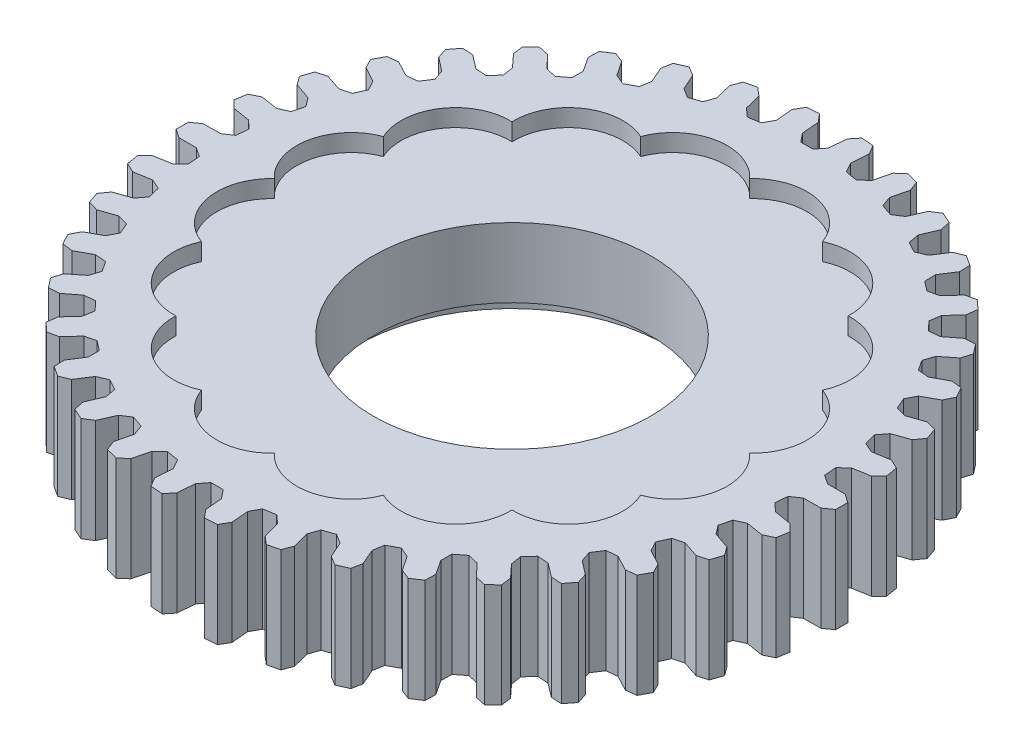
SolidWorks part; units mm, degrees
ref_plane "Front" through (0, 0, 0) normal (0, 0, 1) x (1, 0, 0)
ref_plane "Top" through (0, 0, 0) normal (0, 1, 0) x (1, 0, 0)
ref_plane "Right" through (0, 0, 0) normal (1, 0, 0) x (0, 0, -1)
sketch "Sketch1" plane through (0, 0, 0) normal (0, 0, 1) x (1, 0, 0)
  line L0 (9.5, 3.2951) -> (0, 3.2951)
  line L1 (4.5, 0.2951) -> (9.5, 0.2951)
  line L2 (4.5, 0.2951) -> (4.5, 0.7951)
  line L3 (0, 3.2951) -> (0, 0.7951)
  line L4 (9.5, 0.2951) -> (9.5, 3.2951)
  line L5 (4.5, 0.7951) -> (0, 0.7951)
  dimension "D1" = 3
  dimension "D2" = 9.5
  dimension "D3" = 0.5
  dimension "D5" = 4.5
revolve "Revolve1" add sketch "Sketch1" angle 360 about L3
sketch "Sketch2" plane through (0, 3.2951, 0) normal (0, 1, 0) x (-1, 0, 0)
  arc A16 (-2.6205, -6.3264) -> (-4.842, -4.842) centre (-3.2738, -4.8996) cw
  arc A17 (-4.842, -4.842) -> (-6.3264, -2.6205) centre (-4.8996, -3.2738) cw
  arc A18 (-6.3264, -2.6205) -> (-6.8476, 0) centre (-5.7795, -1.1496) cw
  arc A19 (-6.8476, 0) -> (-6.3264, 2.6205) centre (-5.7795, 1.1496) cw
  arc A20 (-6.3264, 2.6205) -> (-4.842, 4.842) centre (-4.8996, 3.2738) cw
  arc A21 (-4.842, 4.842) -> (-2.6205, 6.3264) centre (-3.2738, 4.8996) cw
  arc A22 (-2.6205, 6.3264) -> (0, 6.8476) centre (-1.1496, 5.7795) cw
  arc A23 (0, 6.8476) -> (2.6205, 6.3264) centre (1.1496, 5.7795) cw
  arc A24 (2.6205, 6.3264) -> (4.842, 4.842) centre (3.2738, 4.8996) cw
  arc A25 (4.842, 4.842) -> (6.3264, 2.6205) centre (4.8996, 3.2738) cw
  arc A26 (6.3264, 2.6205) -> (6.8476, 0) centre (5.7795, 1.1496) cw
  arc A27 (6.8476, 0) -> (6.3264, -2.6205) centre (5.7795, -1.1496) cw
  arc A28 (6.3264, -2.6205) -> (4.842, -4.842) centre (4.8996, -3.2738) cw
  arc A29 (4.842, -4.842) -> (2.6205, -6.3264) centre (3.2738, -4.8996) cw
  arc A30 (2.6205, -6.3264) -> (0, -6.8476) centre (1.1496, -5.7795) cw
  arc A31 (0, -6.8476) -> (-2.6205, -6.3264) centre (-1.1496, -5.7795) cw
extrude "Cut-Extrude1" cut sketch "Sketch2" against normal blind 0.5
sketch "Sketch3" plane through (0, 3.2951, 0) normal (0, 1, 0) x (-1, 0, 0)
  line L0 (2.1568, 9.2453) -> (1.9273, 9.0458)
  line L1 (1.9273, 9.0458) -> (1.8053, 8.5613)
  line L2 (1.8053, 8.5613) -> (1.5711, 8.348)
  line L3 (1.5711, 8.348) -> (1.2246, 8.4058)
  line L4 (1.2246, 8.4058) -> (1.0699, 8.6838)
  line L5 (1.0699, 8.6838) -> (1.1068, 9.1821)
  line L6 (1.1068, 9.1821) -> (0.9521, 9.4455)
  line L7 (0.9521, 9.4455) -> (0.6057, 9.4742)
  line L8 (0.6057, 9.4742) -> (0.4122, 9.2396)
  line L9 (0.4122, 9.2396) -> (0.3716, 8.7417)
  line L10 (0.3716, 8.7417) -> (0.1756, 8.4927)
  line L11 (0.1756, 8.4927) -> (-0.1756, 8.4927)
  line L12 (-0.1756, 8.4927) -> (-0.3741, 8.7415)
  line L13 (-0.3741, 8.7415) -> (-0.4196, 9.239)
  line L14 (-0.4196, 9.239) -> (-0.6156, 9.4734)
  line L15 (-0.6156, 9.4734) -> (-0.962, 9.4447)
  line L16 (3.6491, 8.7642) -> (3.3899, 8.6052)
  line L17 (3.3899, 8.6052) -> (3.1899, 8.1474)
  line L18 (3.1899, 8.1474) -> (2.9237, 7.9756)
  line L19 (2.9237, 7.9756) -> (2.5915, 8.0896)
  line L20 (2.5915, 8.0896) -> (2.4846, 8.3893)
  line L21 (2.4846, 8.3893) -> (2.603, 8.8747)
  line L22 (2.603, 8.8747) -> (2.4937, 9.16)
  line L23 (2.4937, 9.16) -> (2.1568, 9.2453)
  line L24 (5.0419, 8.0441) -> (4.7601, 7.9298)
  line L25 (4.7601, 7.9298) -> (4.4874, 7.5113)
  line L26 (4.4874, 7.5113) -> (4.1966, 7.3855)
  line L27 (4.1966, 7.3855) -> (3.8876, 7.5527)
  line L28 (3.8876, 7.5527) -> (3.8315, 7.8659)
  line L29 (3.8315, 7.8659) -> (4.0282, 8.3252)
  line L30 (4.0282, 8.3252) -> (3.9674, 8.6246)
  line L31 (3.9674, 8.6246) -> (3.6491, 8.7642)
  line L32 (6.2971, 7.1045) -> (6.0003, 7.0382)
  line L33 (6.0003, 7.0382) -> (5.6625, 6.6702)
  line L34 (5.6625, 6.6702) -> (5.3549, 6.5941)
  line L35 (5.3549, 6.5941) -> (5.0778, 6.8098)
  line L36 (5.0778, 6.8098) -> (5.074, 7.128)
  line L37 (5.074, 7.128) -> (5.3436, 7.5486)
  line L38 (5.3436, 7.5486) -> (5.3329, 7.854)
  line L39 (5.3329, 7.854) -> (5.0419, 8.0441)
  line L40 (7.3806, 5.9711) -> (7.077, 5.9546)
  line L41 (7.077, 5.9546) -> (6.6831, 5.6472)
  line L42 (6.6831, 5.6472) -> (6.3673, 5.6228)
  line L43 (6.3673, 5.6228) -> (6.1294, 5.8812)
  line L44 (6.1294, 5.8812) -> (6.178, 6.1957)
  line L45 (6.178, 6.1957) -> (6.5131, 6.5661)
  line L46 (6.5131, 6.5661) -> (6.5529, 6.8691)
  line L47 (6.5529, 6.8691) -> (6.2971, 7.1045)
  line L48 (8.2628, 4.6749) -> (7.9605, 4.7086)
  line L49 (7.9605, 4.7086) -> (7.5215, 4.4702)
  line L50 (7.5215, 4.4702) -> (7.2059, 4.4981)
  line L51 (7.2059, 4.4981) -> (7.0138, 4.7921)
  line L52 (7.0138, 4.7921) -> (7.1135, 5.0943)
  line L53 (7.1135, 5.0943) -> (7.5051, 5.4046)
  line L54 (7.5051, 5.4046) -> (7.5941, 5.6968)
  line L55 (7.5941, 5.6968) -> (7.3806, 5.9711)
  line L56 (8.9195, 3.2511) -> (8.627, 3.3341)
  line L57 (8.627, 3.3341) -> (8.1547, 3.1712)
  line L58 (8.1547, 3.1712) -> (7.848, 3.2507)
  line L59 (7.848, 3.2507) -> (7.7069, 3.5723)
  line L60 (7.7069, 3.5723) -> (7.855, 3.854)
  line L61 (7.855, 3.854) -> (8.2923, 4.0955)
  line L62 (8.2923, 4.0955) -> (8.4282, 4.3692)
  line L63 (8.4282, 4.3692) -> (8.2628, 4.6749)
  line L64 (9.333, 1.7387) -> (9.0581, 1.8687)
  line L65 (9.0581, 1.8687) -> (8.5654, 1.7858)
  line L66 (8.5654, 1.7858) -> (8.276, 1.9146)
  line L67 (8.276, 1.9146) -> (8.1897, 2.2551)
  line L68 (8.1897, 2.2551) -> (8.3822, 2.5085)
  line L69 (8.3822, 2.5085) -> (8.8533, 2.6748)
  line L70 (8.8533, 2.6748) -> (9.0324, 2.9224)
  line L71 (9.0324, 2.9224) -> (8.9195, 3.2511)
  line L72 (9.4919, 0.1788) -> (9.2421, 0.3523)
  line L73 (9.2421, 0.3523) -> (8.7425, 0.3516)
  line L74 (8.7425, 0.3516) -> (8.4782, 0.5263)
  line L75 (8.4782, 0.5263) -> (8.4492, 0.8764)
  line L76 (8.4492, 0.8764) -> (8.6807, 1.0946)
  line L77 (8.6807, 1.0946) -> (9.1728, 1.1811)
  line L78 (9.1728, 1.1811) -> (9.3902, 1.3958)
  line L79 (9.3902, 1.3958) -> (9.333, 1.7387)
  line L80 (9.3919, -1.386) -> (9.174, -1.1737)
  line L81 (9.174, -1.1737) -> (8.6812, -1.0922)
  line L82 (8.6812, -1.0922) -> (8.4492, -0.8764)
  line L83 (8.4492, -0.8764) -> (8.4782, -0.5263)
  line L84 (8.4782, -0.5263) -> (8.7425, -0.3491)
  line L85 (8.7425, -0.3491) -> (9.2421, -0.3448)
  line L86 (9.2421, -0.3448) -> (9.4919, -0.1688)
  line L87 (9.4919, -0.1688) -> (9.4919, 0.1788)
  line L88 (9.0356, -2.9129) -> (8.8557, -2.6677)
  line L89 (8.8557, -2.6677) -> (8.383, -2.5062)
  line L90 (8.383, -2.5062) -> (8.1897, -2.2551)
  line L91 (8.1897, -2.2551) -> (8.276, -1.9146)
  line L92 (8.276, -1.9146) -> (8.5658, -1.7833)
  line L93 (8.5658, -1.7833) -> (9.0593, -1.8613)
  line L94 (9.0593, -1.8613) -> (9.3346, -1.7288)
  line L95 (9.3346, -1.7288) -> (9.3919, -1.386)
  line L96 (8.433, -4.3604) -> (8.2958, -4.089)
  line L97 (8.2958, -4.089) -> (7.8562, -3.8518)
  line L98 (7.8562, -3.8518) -> (7.7069, -3.5723)
  line L99 (7.7069, -3.5723) -> (7.848, -3.2507)
  line L100 (7.848, -3.2507) -> (8.1555, -3.1689)
  line L101 (8.1555, -3.1689) -> (8.6294, -3.327)
  line L102 (8.6294, -3.327) -> (8.9228, -3.2417)
  line L103 (8.9228, -3.2417) -> (9.0356, -2.9129)
  line L104 (7.6002, -5.6889) -> (7.5097, -5.3986)
  line L105 (7.5097, -5.3986) -> (7.115, -5.0923)
  line L106 (7.115, -5.0923) -> (7.0138, -4.7921)
  line L107 (7.0138, -4.7921) -> (7.2059, -4.4981)
  line L108 (7.2059, -4.4981) -> (7.5227, -4.468)
  line L109 (7.5227, -4.468) -> (7.9641, -4.702)
  line L110 (7.9641, -4.702) -> (8.2675, -4.6661)
  line L111 (8.2675, -4.6661) -> (8.433, -4.3604)
  line L112 (6.5602, -6.8623) -> (6.5187, -6.5611)
  line L113 (6.5187, -6.5611) -> (6.1798, -6.194)
  line L114 (6.1798, -6.194) -> (6.1294, -5.8812)
  line L115 (6.1294, -5.8812) -> (6.3673, -5.6228)
  line L116 (6.3673, -5.6228) -> (6.6847, -5.6453)
  line L117 (6.6847, -5.6453) -> (7.0816, -5.9487)
  line L118 (7.0816, -5.9487) -> (7.3868, -5.9632)
  line L119 (7.3868, -5.9632) -> (7.6002, -5.6889)
  line L120 (5.3412, -7.8485) -> (5.3498, -7.5445)
  line L121 (5.3498, -7.5445) -> (5.0761, -7.1266)
  line L122 (5.0761, -7.1266) -> (5.0778, -6.8098)
  line L123 (5.0778, -6.8098) -> (5.3549, -6.5941)
  line L124 (5.3549, -6.5941) -> (5.6643, -6.6685)
  line L125 (5.6643, -6.6685) -> (6.0059, -7.0331)
  line L126 (6.0059, -7.0331) -> (6.3045, -7.0977)
  line L127 (6.3045, -7.0977) -> (6.5602, -6.8623)
  line L128 (3.9766, -8.6206) -> (4.0351, -8.3222)
  line L129 (4.0351, -8.3222) -> (3.8338, -7.8649)
  line L130 (3.8338, -7.8649) -> (3.8876, -7.5527)
  line L131 (3.8876, -7.5527) -> (4.1966, -7.3855)
  line L132 (4.1966, -7.3855) -> (4.4895, -7.5099)
  line L133 (4.4895, -7.5099) -> (4.7663, -7.9257)
  line L134 (4.7663, -7.9257) -> (5.0503, -8.0386)
  line L135 (5.0503, -8.0386) -> (5.3412, -7.8485)
  line L136 (2.5034, -9.1575) -> (2.6103, -8.8728)
  line L137 (2.6103, -8.8728) -> (2.487, -8.3887)
  line L138 (2.487, -8.3887) -> (2.5915, -8.0896)
  line L139 (2.5915, -8.0896) -> (2.9237, -7.9756)
  line L140 (2.9237, -7.9756) -> (3.1921, -8.1464)
  line L141 (3.1921, -8.1464) -> (3.3968, -8.6022)
  line L142 (3.3968, -8.6022) -> (3.6583, -8.7602)
  line L143 (3.6583, -8.7602) -> (3.9766, -8.6206)
  line L144 (0.962, -9.4447) -> (1.1143, -9.1814)
  line L145 (1.1143, -9.1814) -> (1.0723, -8.6836)
  line L146 (1.0723, -8.6836) -> (1.2246, -8.4058)
  line L147 (1.2246, -8.4058) -> (1.5711, -8.348)
  line L148 (1.5711, -8.348) -> (1.8078, -8.5607)
  line L149 (1.8078, -8.5607) -> (1.9346, -9.0439)
  line L150 (1.9346, -9.0439) -> (2.1665, -9.2429)
  line L151 (2.1665, -9.2429) -> (2.5034, -9.1575)
  line L152 (-0.6057, -9.4742) -> (-0.4122, -9.2396)
  line L153 (-0.4122, -9.2396) -> (-0.3716, -8.7417)
  line L154 (-0.3716, -8.7417) -> (-0.1756, -8.4927)
  line L155 (-0.1756, -8.4927) -> (0.1756, -8.4927)
  line L156 (0.1756, -8.4927) -> (0.3741, -8.7415)
  line L157 (0.3741, -8.7415) -> (0.4196, -9.239)
  line L158 (0.4196, -9.239) -> (0.6156, -9.4734)
  line L159 (0.6156, -9.4734) -> (0.962, -9.4447)
  line L160 (-2.1568, -9.2453) -> (-1.9273, -9.0458)
  line L161 (-1.9273, -9.0458) -> (-1.8053, -8.5613)
  line L162 (-1.8053, -8.5613) -> (-1.5711, -8.348)
  line L163 (-1.5711, -8.348) -> (-1.2246, -8.4058)
  line L164 (-1.2246, -8.4058) -> (-1.0699, -8.6838)
  line L165 (-1.0699, -8.6838) -> (-1.1068, -9.1821)
  line L166 (-1.1068, -9.1821) -> (-0.9521, -9.4455)
  line L167 (-0.9521, -9.4455) -> (-0.6057, -9.4742)
  line L168 (-3.6491, -8.7642) -> (-3.3899, -8.6052)
  line L169 (-3.3899, -8.6052) -> (-3.1899, -8.1474)
  line L170 (-3.1899, -8.1474) -> (-2.9237, -7.9756)
  line L171 (-2.9237, -7.9756) -> (-2.5915, -8.0896)
  line L172 (-2.5915, -8.0896) -> (-2.4846, -8.3893)
  line L173 (-2.4846, -8.3893) -> (-2.603, -8.8747)
  line L174 (-2.603, -8.8747) -> (-2.4937, -9.16)
  line L175 (-2.4937, -9.16) -> (-2.1568, -9.2453)
  line L176 (-5.0419, -8.0441) -> (-4.7601, -7.9298)
  line L177 (-4.7601, -7.9298) -> (-4.4874, -7.5113)
  line L178 (-4.4874, -7.5113) -> (-4.1966, -7.3855)
  line L179 (-4.1966, -7.3855) -> (-3.8876, -7.5527)
  line L180 (-3.8876, -7.5527) -> (-3.8315, -7.8659)
  line L181 (-3.8315, -7.8659) -> (-4.0282, -8.3252)
  line L182 (-4.0282, -8.3252) -> (-3.9674, -8.6246)
  line L183 (-3.9674, -8.6246) -> (-3.6491, -8.7642)
  line L184 (-6.2971, -7.1045) -> (-6.0003, -7.0382)
  line L185 (-6.0003, -7.0382) -> (-5.6625, -6.6702)
  line L186 (-5.6625, -6.6702) -> (-5.3549, -6.5941)
  line L187 (-5.3549, -6.5941) -> (-5.0778, -6.8098)
  line L188 (-5.0778, -6.8098) -> (-5.074, -7.128)
  line L189 (-5.074, -7.128) -> (-5.3436, -7.5486)
  line L190 (-5.3436, -7.5486) -> (-5.3329, -7.854)
  line L191 (-5.3329, -7.854) -> (-5.0419, -8.0441)
  line L192 (-7.3806, -5.9711) -> (-7.077, -5.9546)
  line L193 (-7.077, -5.9546) -> (-6.6831, -5.6472)
  line L194 (-6.6831, -5.6472) -> (-6.3673, -5.6228)
  line L195 (-6.3673, -5.6228) -> (-6.1294, -5.8812)
  line L196 (-6.1294, -5.8812) -> (-6.178, -6.1957)
  line L197 (-6.178, -6.1957) -> (-6.5131, -6.5661)
  line L198 (-6.5131, -6.5661) -> (-6.5529, -6.8691)
  line L199 (-6.5529, -6.8691) -> (-6.2971, -7.1045)
  line L200 (-8.2628, -4.6749) -> (-7.9605, -4.7086)
  line L201 (-7.9605, -4.7086) -> (-7.5215, -4.4702)
  line L202 (-7.5215, -4.4702) -> (-7.2059, -4.4981)
  line L203 (-7.2059, -4.4981) -> (-7.0138, -4.7921)
  line L204 (-7.0138, -4.7921) -> (-7.1135, -5.0943)
  line L205 (-7.1135, -5.0943) -> (-7.5051, -5.4046)
  line L206 (-7.5051, -5.4046) -> (-7.5941, -5.6968)
  line L207 (-7.5941, -5.6968) -> (-7.3806, -5.9711)
  line L208 (-8.9195, -3.2511) -> (-8.627, -3.3341)
  line L209 (-8.627, -3.3341) -> (-8.1547, -3.1712)
  line L210 (-8.1547, -3.1712) -> (-7.848, -3.2507)
  line L211 (-7.848, -3.2507) -> (-7.7069, -3.5723)
  line L212 (-7.7069, -3.5723) -> (-7.855, -3.854)
  line L213 (-7.855, -3.854) -> (-8.2923, -4.0955)
  line L214 (-8.2923, -4.0955) -> (-8.4282, -4.3692)
  line L215 (-8.4282, -4.3692) -> (-8.2628, -4.6749)
  line L216 (-9.333, -1.7387) -> (-9.0581, -1.8687)
  line L217 (-9.0581, -1.8687) -> (-8.5654, -1.7858)
  line L218 (-8.5654, -1.7858) -> (-8.276, -1.9146)
  line L219 (-8.276, -1.9146) -> (-8.1897, -2.2551)
  line L220 (-8.1897, -2.2551) -> (-8.3822, -2.5085)
  line L221 (-8.3822, -2.5085) -> (-8.8533, -2.6748)
  line L222 (-8.8533, -2.6748) -> (-9.0324, -2.9224)
  line L223 (-9.0324, -2.9224) -> (-8.9195, -3.2511)
  line L224 (-9.4919, -0.1788) -> (-9.2421, -0.3523)
  line L225 (-9.2421, -0.3523) -> (-8.7425, -0.3516)
  line L226 (-8.7425, -0.3516) -> (-8.4782, -0.5263)
  line L227 (-8.4782, -0.5263) -> (-8.4492, -0.8764)
  line L228 (-8.4492, -0.8764) -> (-8.6807, -1.0946)
  line L229 (-8.6807, -1.0946) -> (-9.1728, -1.1811)
  line L230 (-9.1728, -1.1811) -> (-9.3902, -1.3958)
  line L231 (-9.3902, -1.3958) -> (-9.333, -1.7387)
  line L232 (-9.3919, 1.386) -> (-9.174, 1.1737)
  line L233 (-9.174, 1.1737) -> (-8.6812, 1.0922)
  line L234 (-8.6812, 1.0922) -> (-8.4492, 0.8764)
  line L235 (-8.4492, 0.8764) -> (-8.4782, 0.5263)
  line L236 (-8.4782, 0.5263) -> (-8.7425, 0.3491)
  line L237 (-8.7425, 0.3491) -> (-9.2421, 0.3448)
  line L238 (-9.2421, 0.3448) -> (-9.4919, 0.1688)
  line L239 (-9.4919, 0.1688) -> (-9.4919, -0.1788)
  line L240 (-9.0356, 2.9129) -> (-8.8557, 2.6677)
  line L241 (-8.8557, 2.6677) -> (-8.383, 2.5062)
  line L242 (-8.383, 2.5062) -> (-8.1897, 2.2551)
  line L243 (-8.1897, 2.2551) -> (-8.276, 1.9146)
  line L244 (-8.276, 1.9146) -> (-8.5658, 1.7833)
  line L245 (-8.5658, 1.7833) -> (-9.0593, 1.8613)
  line L246 (-9.0593, 1.8613) -> (-9.3346, 1.7288)
  line L247 (-9.3346, 1.7288) -> (-9.3919, 1.386)
  line L248 (-8.433, 4.3604) -> (-8.2958, 4.089)
  line L249 (-8.2958, 4.089) -> (-7.8562, 3.8518)
  line L250 (-7.8562, 3.8518) -> (-7.7069, 3.5723)
  line L251 (-7.7069, 3.5723) -> (-7.848, 3.2507)
  line L252 (-7.848, 3.2507) -> (-8.1555, 3.1689)
  line L253 (-8.1555, 3.1689) -> (-8.6294, 3.327)
  line L254 (-8.6294, 3.327) -> (-8.9228, 3.2417)
  line L255 (-8.9228, 3.2417) -> (-9.0356, 2.9129)
  line L256 (-7.6002, 5.6889) -> (-7.5097, 5.3986)
  line L257 (-7.5097, 5.3986) -> (-7.115, 5.0923)
  line L258 (-7.115, 5.0923) -> (-7.0138, 4.7921)
  line L259 (-7.0138, 4.7921) -> (-7.2059, 4.4981)
  line L260 (-7.2059, 4.4981) -> (-7.5227, 4.468)
  line L261 (-7.5227, 4.468) -> (-7.9641, 4.702)
  line L262 (-7.9641, 4.702) -> (-8.2675, 4.6661)
  line L263 (-8.2675, 4.6661) -> (-8.433, 4.3604)
  line L264 (-6.5602, 6.8623) -> (-6.5187, 6.5611)
  line L265 (-6.5187, 6.5611) -> (-6.1798, 6.194)
  line L266 (-6.1798, 6.194) -> (-6.1294, 5.8812)
  line L267 (-6.1294, 5.8812) -> (-6.3673, 5.6228)
  line L268 (-6.3673, 5.6228) -> (-6.6847, 5.6453)
  line L269 (-6.6847, 5.6453) -> (-7.0816, 5.9487)
  line L270 (-7.0816, 5.9487) -> (-7.3868, 5.9632)
  line L271 (-7.3868, 5.9632) -> (-7.6002, 5.6889)
  line L272 (-5.3412, 7.8485) -> (-5.3498, 7.5445)
  line L273 (-5.3498, 7.5445) -> (-5.0761, 7.1266)
  line L274 (-5.0761, 7.1266) -> (-5.0778, 6.8098)
  line L275 (-5.0778, 6.8098) -> (-5.3549, 6.5941)
  line L276 (-5.3549, 6.5941) -> (-5.6643, 6.6685)
  line L277 (-5.6643, 6.6685) -> (-6.0059, 7.0331)
  line L278 (-6.0059, 7.0331) -> (-6.3045, 7.0977)
  line L279 (-6.3045, 7.0977) -> (-6.5602, 6.8623)
  line L280 (-3.9766, 8.6206) -> (-4.0351, 8.3222)
  line L281 (-4.0351, 8.3222) -> (-3.8338, 7.8649)
  line L282 (-3.8338, 7.8649) -> (-3.8876, 7.5527)
  line L283 (-3.8876, 7.5527) -> (-4.1966, 7.3855)
  line L284 (-4.1966, 7.3855) -> (-4.4895, 7.5099)
  line L285 (-4.4895, 7.5099) -> (-4.7663, 7.9257)
  line L286 (-4.7663, 7.9257) -> (-5.0503, 8.0386)
  line L287 (-5.0503, 8.0386) -> (-5.3412, 7.8485)
  line L288 (-2.5034, 9.1575) -> (-2.6103, 8.8728)
  line L289 (-2.6103, 8.8728) -> (-2.487, 8.3887)
  line L290 (-2.487, 8.3887) -> (-2.5915, 8.0896)
  line L291 (-2.5915, 8.0896) -> (-2.9237, 7.9756)
  line L292 (-2.9237, 7.9756) -> (-3.1921, 8.1464)
  line L293 (-3.1921, 8.1464) -> (-3.3968, 8.6022)
  line L294 (-3.3968, 8.6022) -> (-3.6583, 8.7602)
  line L295 (-3.6583, 8.7602) -> (-3.9766, 8.6206)
  line L296 (-0.962, 9.4447) -> (-1.1143, 9.1814)
  line L297 (-1.1143, 9.1814) -> (-1.0723, 8.6836)
  line L298 (-1.0723, 8.6836) -> (-1.2246, 8.4058)
  line L299 (-1.2246, 8.4058) -> (-1.5711, 8.348)
  line L300 (-1.5711, 8.348) -> (-1.8078, 8.5607)
  line L301 (-1.8078, 8.5607) -> (-1.9346, 9.0439)
  line L302 (-1.9346, 9.0439) -> (-2.1665, 9.2429)
  line L303 (-2.1665, 9.2429) -> (-2.5034, 9.1575)
  circle A0 centre (0, 0) radius 9.5
extrude "Cut-Extrude2" cut sketch "Sketch3" against normal through all
sketch "Sketch6" plane through (0, 2.7951, 0) normal (0, 1, 0) x (-1, 0, 0)
  circle A0 centre (0, 0) radius 4
  dimension "D1" = 8
extrude "Cut-Extrude5" cut sketch "Sketch6" against normal through all
